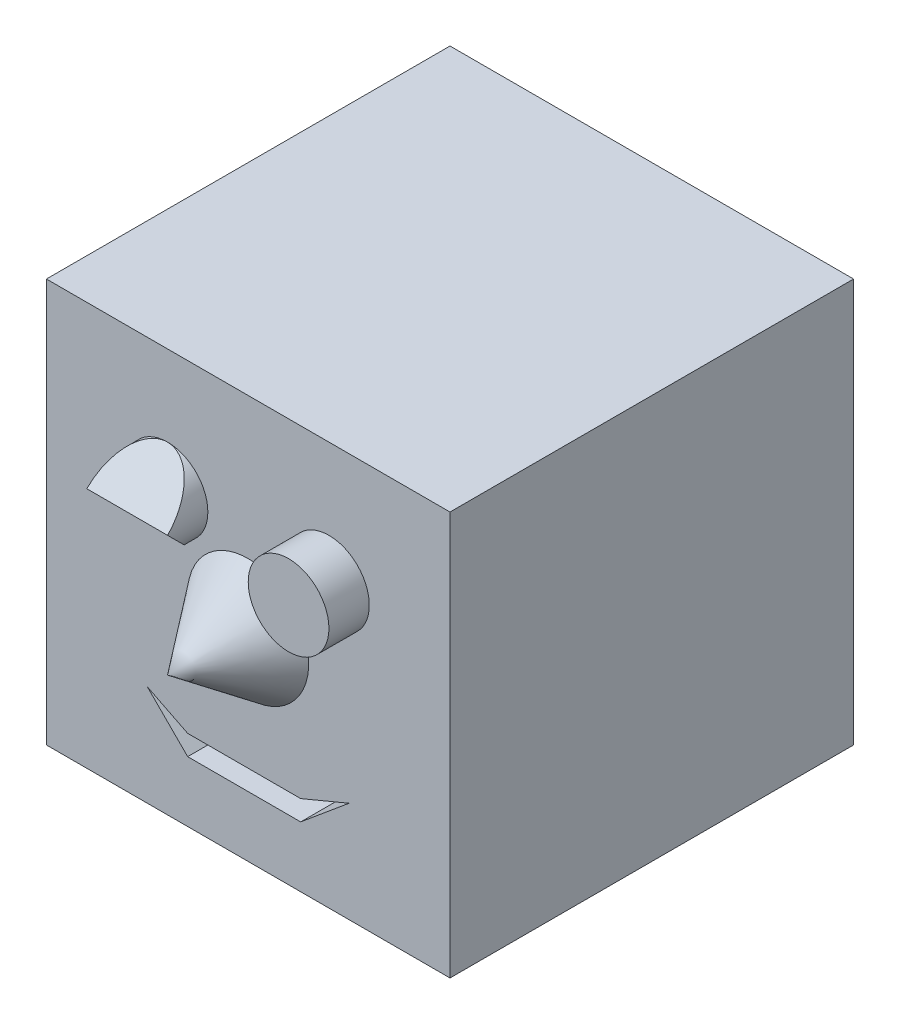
SolidWorks part; units mm, degrees
ref_plane "Front Plane" through (0, 0, 0) normal (0, 0, 1) x (1, 0, 0)
ref_plane "Top Plane" through (0, 0, 0) normal (0, 1, 0) x (1, 0, 0)
ref_plane "Right Plane" through (0, 0, 0) normal (1, 0, 0) x (0, 0, -1)
sketch "Sketch1" plane through (0, 0, 0) normal (0, 0, 1) x (1, 0, 0)
  line L1 (0, 0) -> (25, 0)
  line L2 (0, 0) -> (0, 25)
  line L3 (0, 25) -> (25, 25)
  line L4 (25, 0) -> (25, 25)
  dimension "D1" = 25
  dimension "D2" = 25
extrude "Extrude1" add sketch "Sketch1" against normal blind 25
sketch "Sketch2" plane through (0, 0, 0) normal (0, 0, 1) x (1, 0, 0)
  line L0 (0, 25) -> (0, 0) construction
  line L1 (25, 25) -> (0, 25) construction
  circle A0 centre (7.5, 17.5) radius 2.5
  dimension "D3" = 5
  dimension "D1" = 7.5
  dimension "D2" = 7.5
extrude "Extrude2" add sketch "Sketch2" along normal blind 10
sketch "Sketch3" plane through (0, 0, 0) normal (-1, 0, 0) x (0, 0, 1)
  line L0 (0, 20) -> (12, 20)
  line L1 (12, 20) -> (12, 15)
  line L2 (12, 15) -> (0, 15)
  line L3 (0, 15) -> (2.5, 17.5)
  line L4 (2.5, 17.5) -> (0, 20)
  line L6 (0, 25) -> (0, 0) construction
  line L7 (-25, 25) -> (0, 25) construction
  dimension "D1" = 12
  dimension "D2" = 12
  dimension "D3" = 5
  dimension "D4" = 5
  dimension "D5" = 2.5
  dimension "D6" = 2.5
extrude "Cut-Extrude1" cut sketch "Sketch3" against normal through all
sketch "Sketch4" plane through (0, 0, 0) normal (0, 0, 1) x (1, 0, 0)
  line L0 (0, 25) -> (0, 0) construction
  line L1 (25, 25) -> (0, 25) construction
  circle A0 centre (17.5, 17.5) radius 2.5
  dimension "D3" = 5
  dimension "D1" = 17.5
  dimension "D2" = 7.5
extrude "Extrude3" add sketch "Sketch4" along normal blind 2.5
sketch "Sketch9" plane through (0, 0, 0) normal (0, 0, 1) x (1, 0, 0)
  line L0 (0, 25) -> (0, 0) construction
  line L1 (25, 25) -> (0, 25) construction
  circle A0 centre (12.5, 12.5) radius 3.75
  dimension "D3" = 7.5
  dimension "D1" = 12.5
  dimension "D2" = 12.5
sketch "Sketch10" plane through (0, 0, 0) normal (0, 0, 1) x (1, 0, 0)
  line L0 (6.25, 6.25) -> (8.75, 5)
  line L1 (8.75, 5) -> (15.75, 5)
  line L2 (15.75, 5) -> (18.75, 6.25)
  line L3 (18.75, 6.25) -> (15.75, 3.75)
  line L4 (15.75, 3.75) -> (8.75, 3.75)
  line L5 (8.75, 3.75) -> (6.25, 6.25)
  line L6 (0, 25) -> (0, 0) construction
  line L7 (0, 0) -> (25, 0) construction
  dimension "D1" = 8.75
  dimension "D2" = 6.25
  dimension "D3" = 7
  dimension "D4" = 18.75
  dimension "D5" = 5
  dimension "D6" = 6.25
  dimension "D7" = 3.75
extrude "Cut-Extrude2" cut sketch "Sketch10" against normal blind 2.5
ref_plane "Plane1" through (12.5, 0, 0) normal (1, 0, 0) x (0, 0, -1)
sketch "Sketch13" plane through (12.5, 0, 0) normal (1, 0, 0) x (0, 0, -1)
  line L0 (0, 12.5) -> (-20.0611, 12.5) construction
  line L1 (0, 0) -> (0, 25) construction
  line L3 (0, 12.5) -> (-5, 12.5)
  line L4 (-5, 12.5) -> (0, 16.25)
  line L5 (0, 16.25) -> (0, 12.5)
  dimension "D1" = 5
  dimension "D2" = 3.75
revolve "Revolve1" add sketch "Sketch13" angle 360 about L0
sketch "Sketch16" plane through (0, 25, 0) normal (0, 1, 0) x (-1, 0, 0)
  text T0 "     Darth         Vader      Princess         Lea" font "Arial Rounded MT Bold" height in points 14
